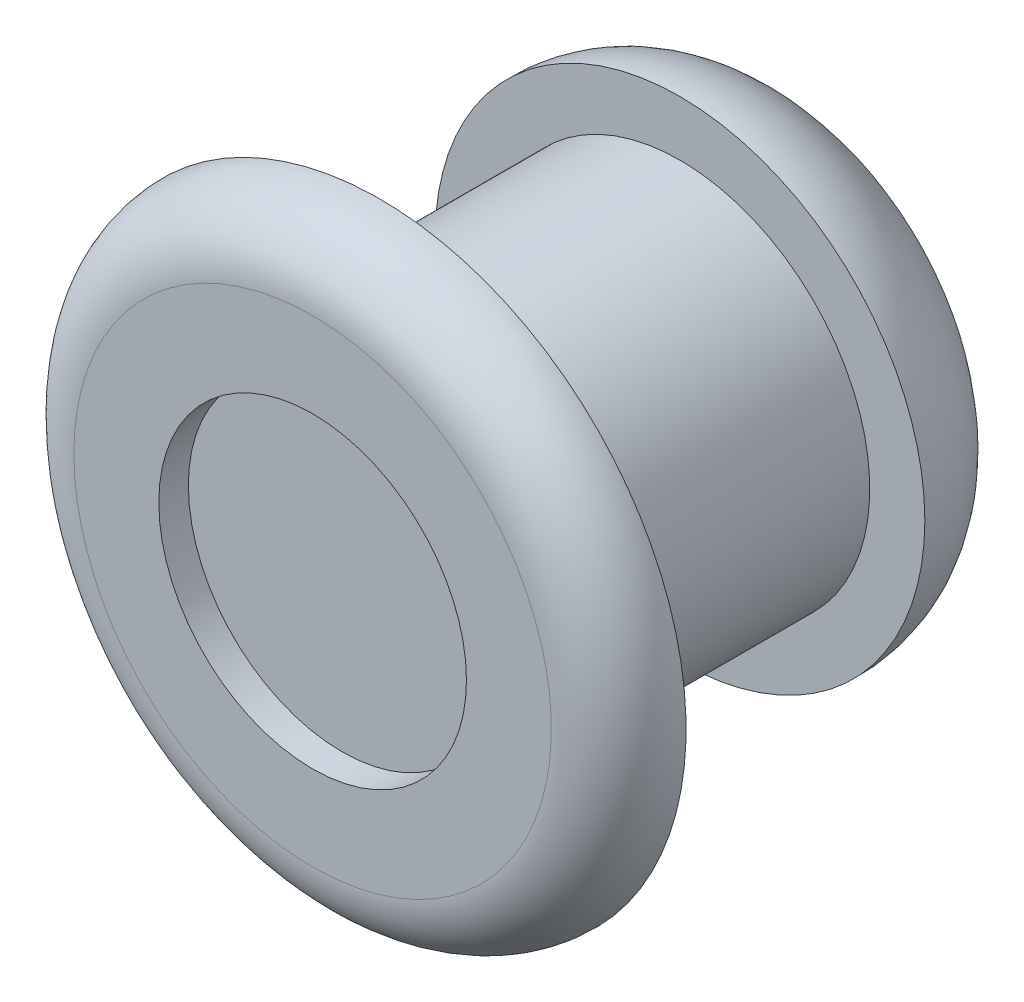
SolidWorks part; units mm, degrees
ref_plane "Plan de face" through (0, 0, 0) normal (0, 0, 1) x (1, 0, 0)
ref_plane "Plan de dessus" through (0, 0, 0) normal (0, 1, 0) x (1, 0, 0)
ref_plane "Plan de droite" through (0, 0, 0) normal (1, 0, 0) x (0, 0, -1)
sketch "Esquisse2" plane through (0, 0, 0) normal (0, 0, 1) x (1, 0, 0)
  point P0 (44.0001, -44.4602)
ref_plane "Plan4" through (44.0001, 0, 0) normal (1, 0, 0) x (0, 0, -1)
sketch "Esquisse3" plane through (44.0001, 0, 0) normal (1, 0, 0) x (0, 0, -1)
  line L0 (4.9, -41.3602) -> (0, -41.3602)
  line L1 (4.9, -47.5602) -> (4.9, -41.3602) construction
  line L2 (0, -41.3602) -> (0, -47.5602) construction
  line L3 (0, -41.3602) -> (0, -39.4602)
  line L4 (0, 44.4735) -> (0, -44.4668) construction
  line L5 (4.9, -41.3602) -> (4.9, -40.4602)
  line L6 (6.9, -42.7102) -> (6.9, -42.3289)
  line L7 (4.9, -44.4602) -> (2.3, -44.4602) construction
  line L8 (-0.6172, -42.7102) -> (-0.6172, -41.9476)
  line L9 (-0.6172, -41.9476) -> (-1.1, -41.9476)
  line L10 (-1.1, -41.9476) -> (-1.1, -40.5602)
  line L11 (0, -38.4102) -> (0, -50.51) construction
  line L12 (0, -44.4602) -> (4.9, -44.4602) construction
  line L13 (0.9592, -42.7102) -> (6.9, -42.7102)
  line L14 (0.9592, -42.7102) -> (0.9592, -44.4602)
  line L15 (0.9592, -44.4602) -> (-0.6172, -44.4602)
  line L16 (0.5, -44.4602) -> (0.2, -44.4602) construction
  line L17 (-0.6172, -44.4602) -> (-0.6172, -42.7102)
  line L18 (4.9, -44.4602) -> (-2.1886, -44.4602) construction
  arc A1 (0, -39.4602) -> (-1.1, -40.5602) centre (0, -40.5602) ccw
  arc A2 (4.9, -40.4602) -> (6.9, -42.3289) centre (4.9657, -42.3946) cw
  dimension "D1" = 1.1
  dimension "D2" = 5
  dimension "D4" = 1.75
revolve "Révolution1" add sketch "Esquisse3" angle 360 about L18
